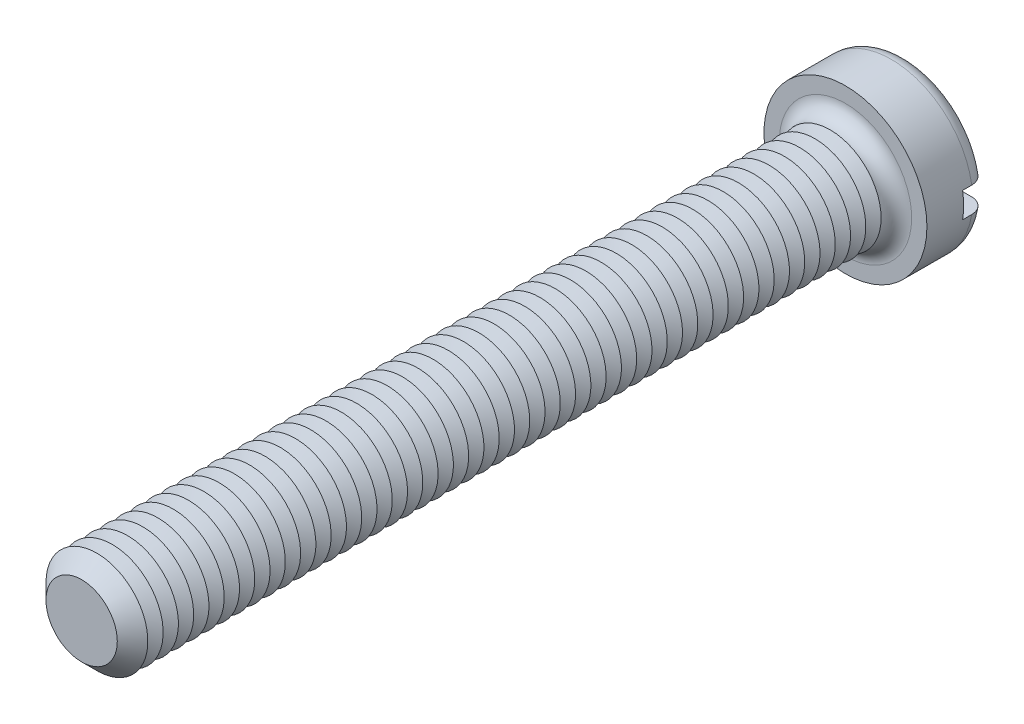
SolidWorks part; units mm, degrees
ref_plane "Front Plane" through (0, 0, 0) normal (0, 0, 1) x (1, 0, 0)
ref_plane "Top Plane" through (0, 0, 0) normal (0, 1, 0) x (1, 0, 0)
ref_plane "Right Plane" through (0, 0, 0) normal (1, 0, 0) x (0, 0, -1)
sketch "Sketch3" plane through (0, 0, 0) normal (0, 0, 1) x (1, 0, 0)
  circle A0 centre (0, 0) radius 8
  dimension "D1" = 16
extrude "Boss-Extrude2" add sketch "Sketch3" against normal blind 6
sketch "Sketch4" plane through (0, 0, 0) normal (0, 0, 1) x (1, 0, 0)
  circle A0 centre (0, 0) radius 5
  dimension "D1" = 10
extrude "Boss-Extrude3" add sketch "Sketch4" along normal blind 75
fillet "Fillet1" radius 1.5 2 edges at (8, 0, -6) (5, 0, 0)
chamfer "Chamfer1" distance 1.5 angle 45 1 edges at (5, 0, 75)
sketch "Sketch5" plane through (0, 0, 0) normal (1, 0, 0) x (0, 0, -1)
  line L0 (1.6944, 0) -> (-7.6738, 0) construction
sketch "Sketch6" plane through (0, 0, 0) normal (1, 0, 0) x (0, 0, -1)
  line L0 (-1.5, 5) -> (-2.25, 3.701)
  line L1 (-2.25, 3.701) -> (-3, 5)
  line L2 (-1.5, 5) -> (-73.5, 5) construction
  line L3 (-3, 5) -> (-1.5, 5)
  dimension "D1" = 1.5
revolve "Cut-Revolve1" cut sketch "Sketch6" angle 360 about L0
pattern_linear "LPattern1" count 48 spacing 1.5 along (0, 0, 1) of "Cut-Revolve1"
sketch "Sketch8" plane through (0, 0, -6) normal (0, 0, -1) x (-1, 0, 0)
  line L1 (8, -1.25) -> (-8, -1.25)
  line L2 (8, -1.25) -> (8, 1.25)
  line L3 (8, 1.25) -> (-8, 1.25)
  line L4 (-8, -1.25) -> (-8, 1.25)
  line L5 (8, -1.25) -> (-8, 1.25) construction
  line L6 (8, 1.25) -> (-8, -1.25) construction
  point P0 (0, 0)
  dimension "D1" = 16
  dimension "D2" = 2.5
extrude "Cut-Extrude1" cut sketch "Sketch8" against normal blind 2.4
